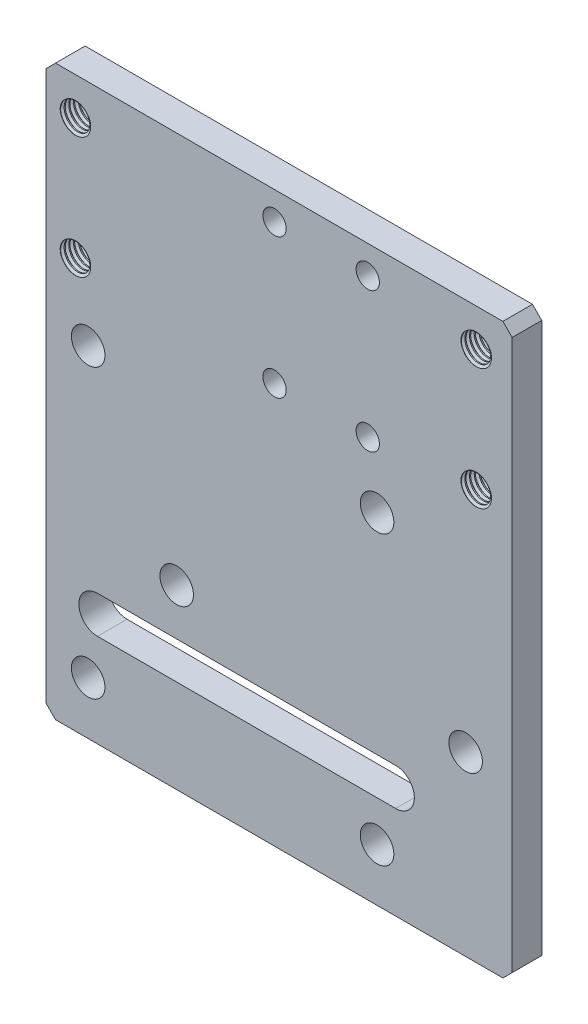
SolidWorks part; units mm, degrees
ref_plane "Front Plane" through (0, 0, 0) normal (0, 0, 1) x (1, 0, 0)
ref_plane "Top Plane" through (0, 0, 0) normal (0, 1, 0) x (1, 0, 0)
ref_plane "Right Plane" through (0, 0, 0) normal (1, 0, 0) x (0, 0, -1)
sketch "Sketch1" plane through (0, 0, 0) normal (0, 0, 1) x (1, 0, 0)
  line L17 (4.5, -7.5) -> (14.5, 7.5) construction
  line L23 (4.5, -7.5) -> (14.5, -7.5)
  line L25 (4.5, -7.5) -> (4.5, 7.5)
  line L26 (4.5, 7.5) -> (14.5, 7.5)
  line L27 (14.5, -7.5) -> (14.5, 7.5)
  line L28 (4.5, 7.5) -> (14.5, -7.5) construction
  line L29 (9.5, -31.5) -> (9.5, 17.2307) construction
  line L30 (-6, -31.5) -> (25, -31.5)
  line L33 (-20, -34.486) -> (-20, 10.514)
  line L34 (-20, 10.514) -> (30, 10.514)
  line L35 (30, -50.5022) -> (30, 10.514)
  line L39 (-19.5, -17.5) -> (-19.5, -10.5) construction
  line L41 (19.5, -17.5) -> (19.5, -10.5) construction
  line L46 (-20, -34.486) -> (-20, -50.5022)
  line L49 (-20, -50.5022) -> (30, -50.5022)
  circle A0 centre (-15.5, -14) radius 1.8
  circle A1 centre (15.5, -14) radius 1.8
  circle A2 centre (15.5, -44.8422) radius 1.8
  circle A3 centre (-15.5, -44.8422) radius 1.8
  arc A4 (-4.7966, -30.1614) -> (-4.7966, -32.8386) centre (-6, -31.5) ccw
  arc A5 (-4.7966, -32.8386) -> (-4.7966, -30.1614) centre (-6, -31.5) ccw
  arc A6 (26.2034, -32.8386) -> (26.2034, -30.1614) centre (25, -31.5) ccw
  arc A7 (26.2034, -30.1614) -> (26.2034, -32.8386) centre (25, -31.5) ccw
  circle A10 centre (14.5, -7.5) radius 1.25
  circle A11 centre (4.5, -7.5) radius 1.25
  circle A14 centre (14.5, 7.5) radius 1.25
  circle A15 centre (4.5, 7.5) radius 1.25
  point P18 (9.5, 0)
  dimension "D1" = 2.5
  dimension "D2" = 2.5
  dimension "D3" = 2.5
  dimension "D4" = 2.5
  dimension "D8" = 1.8
  dimension "D9" = 1.8
  dimension "D15" = 5
  dimension "D16" = 3.6
  dimension "D17" = 4
  dimension "D18" = 3.6
  dimension "D19" = 3.6
  dimension "D20" = 31
  dimension "D21" = 3.6
  dimension "D22" = 5.66
  dimension "D25" = 15.5
  dimension "D24" = 15.5
  dimension "D23" = 24.514
  dimension "D5" = 15
  dimension "D6" = 10
  dimension "D7" = 31
  dimension "D10" = 31.5
  dimension "D11" = 7
  dimension "D12" = 45
  dimension "D13" = 50
  dimension "D14" = 39
  dimension "D26" = 19.5
  dimension "D27" = 25
  dimension "D28" = 7.5
  dimension "D29" = 10.514
  dimension "D31" = 26.2034
  dimension "D32" = 26.2034
  dimension "D34" = 10.5
  dimension "D35" = 4.7966
  dimension "D36" = 4.7966
  dimension "D37" = 15.5
  dimension "D38" = 15.5
  dimension "D39" = 10.5
  dimension "D42" = 14
extrude "Boss-Extrude1" add sketch "Sketch1" along normal blind 3.175
sketch "Sketch2" plane through (0, 0, 0) normal (0, 0, -1) x (-1, 0, 0)
  line L0 (20, -50.5022) -> (-30, -50.5022) construction
  line L1 (14.5, -38.5022) -> (-17.5, -38.5022) construction
  line L2 (14.5, -40.5022) -> (-17.5, -40.5022)
  line L3 (14.5, -36.5022) -> (-17.5, -36.5022)
  line L4 (-30, -50.5022) -> (-30, 10.514) construction
  line L22 (34.3356, -38.5022) -> (-20.3976, -38.5022) construction
  arc A1 (14.5, -40.5022) -> (14.5, -36.5022) centre (14.5, -38.5022) ccw
  arc A2 (-17.5, -36.5022) -> (-17.5, -40.5022) centre (-17.5, -38.5022) ccw
  point P10 (-1.5, -38.5022)
  dimension "D2" = 2
  dimension "D3" = 12.5
  dimension "D5" = 10
  dimension "D1" = 32
extrude "Cut-Extrude1" cut sketch "Sketch2" against normal through all contours L3 A2 L2 A1
sketch "Sketch3" plane through (0, 0, 3.175) normal (0, 0, 1) x (1, 0, 0)
  line L0 (14.5, 7.5) -> (14.5, -7.5) construction
  line L1 (14.5, 0) -> (29.044, 0) construction
  line L2 (14.5, 7.5) -> (4.5, 7.5) construction
  line L3 (4.5, 10.514) -> (4.5, -5.4786) construction
  line L4 (-20, 10.514) -> (-20, -50.5022)
  line L5 (-20, -50.5022) -> (30, -50.5022)
  line L6 (30, -50.5022) -> (30, 10.514)
  line L7 (30, 10.514) -> (-20, 10.514)
  line L8 (-20, 10.514) -> (-20, -50.5022) construction
  line L9 (-20, -50.5022) -> (30, -50.5022) construction
  line L10 (30, -50.5022) -> (30, 10.514) construction
  line L11 (30, 10.514) -> (-20, 10.514) construction
  circle A0 centre (26, 6.514) radius 1.5
  circle A1 centre (26, -6.514) radius 1.5
  circle A2 centre (-17, -6.514) radius 1.5
  circle A3 centre (-17, 6.514) radius 1.5
  dimension "D2" = 3
  dimension "D3" = 4
  dimension "D4" = 4
  dimension "D1" = 0
extrude "Cut-Extrude2" cut sketch "Sketch3" against normal blind 10
thread "Thread1" pitch 0.5 start angle 0, offset 1, length 0, pitch 0.5, diameter 3
ref_plane "Plane1" through (27.5, -6.514, -1) normal (0, -1, 0) x (1, 0, 0)
sketch "Thread Profile1" plane through (27.5, -6.514, -1) normal (0, -1, 0) x (1, 0, 0)
  line L0 (0, 0) -> (0, 0.5) construction
  line L1 (0, 0) -> (0.2706, 0.1562)
  line L2 (0.2706, 0.1562) -> (0.2706, 0.2187)
  line L3 (0.2706, 0.2187) -> (0, 0.375)
  line L4 (0.2706, 0.1875) -> (0, 0.1875) construction
  line L11 (0, 0) -> (0, 0.375)
  point P2 (0, 0)
  dimension "Pitch" = 0.5
  dimension "Profile_Angle" = 60
  dimension "Profile_Land" = 0.0625
  dimension "Profile_Height" = 0.2706
thread "Thread2" pitch 0.5 start angle 0, offset 1, length 0, pitch 0.5, diameter 3
ref_plane "Plane2" through (27.5, 6.514, -1) normal (0, -1, 0) x (1, 0, 0)
sketch "Thread Profile2" plane through (27.5, 6.514, -1) normal (0, -1, 0) x (1, 0, 0)
  line L0 (0, 0) -> (0, 0.5) construction
  line L1 (0, 0) -> (0.2706, 0.1562)
  line L2 (0.2706, 0.1562) -> (0.2706, 0.2187)
  line L3 (0.2706, 0.2187) -> (0, 0.375)
  line L4 (0.2706, 0.1875) -> (0, 0.1875) construction
  line L11 (0, 0) -> (0, 0.375)
  point P2 (0, 0)
  dimension "Pitch" = 0.5
  dimension "Profile_Angle" = 60
  dimension "Profile_Land" = 0.0625
  dimension "Profile_Height" = 0.2706
thread "Thread3" pitch 0.5 start angle 0, offset 1, length 0, pitch 0.5, diameter 3
ref_plane "Plane4" through (-15.5, -6.514, -1) normal (0, -1, 0) x (1, 0, 0)
sketch "Thread Profile3" plane through (-15.5, -6.514, -1) normal (0, -1, 0) x (1, 0, 0)
  line L0 (0, 0) -> (0, 0.5) construction
  line L1 (0, 0) -> (0.2706, 0.1562)
  line L2 (0.2706, 0.1562) -> (0.2706, 0.2187)
  line L3 (0.2706, 0.2187) -> (0, 0.375)
  line L4 (0.2706, 0.1875) -> (0, 0.1875) construction
  line L11 (0, 0) -> (0, 0.375)
  point P2 (0, 0)
  dimension "Pitch" = 0.5
  dimension "Profile_Angle" = 60
  dimension "Profile_Land" = 0.0625
  dimension "Profile_Height" = 0.2706
thread "Thread4" pitch 0.5 start angle 0, offset 1, length 0, pitch 0.5, diameter 3
ref_plane "Plane5" through (-15.5, 6.514, -1) normal (0, -1, 0) x (1, 0, 0)
sketch "Thread Profile4" plane through (-15.5, 6.514, -1) normal (0, -1, 0) x (1, 0, 0)
  line L0 (0, 0) -> (0, 0.5) construction
  line L1 (0, 0) -> (0.2706, 0.1562)
  line L2 (0.2706, 0.1562) -> (0.2706, 0.2187)
  line L3 (0.2706, 0.2187) -> (0, 0.375)
  line L4 (0.2706, 0.1875) -> (0, 0.1875) construction
  line L11 (0, 0) -> (0, 0.375)
  point P2 (0, 0)
  dimension "Pitch" = 0.5
  dimension "Profile_Angle" = 60
  dimension "Profile_Land" = 0.0625
  dimension "Profile_Height" = 0.2706
chamfer "Chamfer1" distance 1 angle 45 4 edges at (-20, 10.514, 1.5875) (30, 10.514, 1.5875) (-20, -50.5022, 1.5875) (30, -50.5022, 1.5875)
